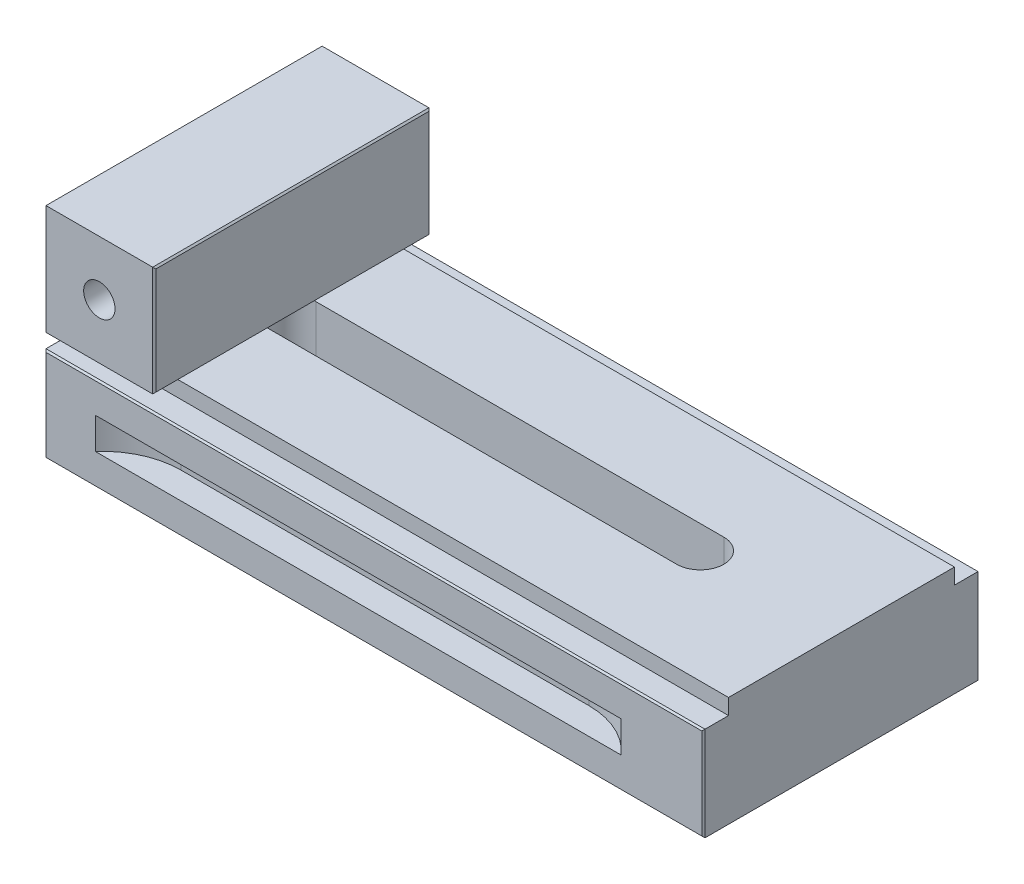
SolidWorks part; units mm, degrees
ref_plane "Face" through (0, 0, 0) normal (0, 0, 1) x (1, 0, 0)
ref_plane "Dessus" through (0, 0, 0) normal (0, 1, 0) x (1, 0, 0)
ref_plane "Droite" through (0, 0, 0) normal (1, 0, 0) x (0, 0, -1)
sketch "Esquisse1" plane through (0, 0, 0) normal (0, 0, 1) x (1, 0, 0)
  line L1 (0, 0) -> (-35, 0)
  line L2 (0, 0) -> (0, -35)
  line L3 (0, -35) -> (-35, -35)
  line L4 (-35, 0) -> (-35, -35)
  dimension "D1" = 35
  dimension "D2" = 35
extrude "Extrusion1" add sketch "Esquisse1" along normal mid plane 88
chamfer "Chanfrein1" distance 0.5 angle 45 8 edges at (-35, -17.5, 44) (0, -17.5, 44) (-35, -17.5, -44) (0, -17.5, -44) (0, -35, 0) (-35, -35, 0) (-35, 0, 0) (0, 0, 0)
sketch "Esquisse2" plane through (0, 0, 44) normal (0, 0, 1) x (1, 0, 0)
  line L0 (0, -35) -> (0, 0) construction
  line L1 (-0.5, 0) -> (-34.5, 0) construction
  circle A0 centre (-17.5, -17.5) radius 5
  dimension "D1" = 17.5
  dimension "D2" = 17.5
  dimension "D3" = 10
extrude "Enlèv. mat.-Extru.1" cut sketch "Esquisse2" against normal through all
sketch "Esquisse3" plane through (-35, 0, 0) normal (-1, 0, 0) x (0, 0, 1)
  line L0 (-36, -35) -> (36, -35)
  line L1 (44, -35) -> (-44, -35) construction
  line L2 (36, -35) -> (36, -40)
  line L3 (36, -40) -> (44, -40)
  line L4 (44, -40) -> (44, -70)
  line L5 (44, -70) -> (-44, -70)
  line L6 (-44, -70) -> (-44, -40)
  line L7 (-44, -40) -> (-36, -40)
  line L8 (-36, -40) -> (-36, -35)
  line L9 (44, 0) -> (44, -35) construction
  line L10 (-44, 0) -> (-44, -35) construction
  dimension "D1" = 8
  dimension "D2" = 5
  dimension "D3" = 35
extrude "Extrusion2" add sketch "Esquisse3" against normal blind 210
sketch "Esquisse4" plane through (0, -35, 0) normal (0, 1, 0) x (-1, 0, 0)
  line L0 (0, -7.5) -> (-130, -7.5)
  line L1 (-130, 7.5) -> (0, 7.5)
  arc A0 (-130, -7.5) -> (-130, 7.5) centre (-130, 0) cw
  arc A1 (0, -7.5) -> (0, 7.5) centre (0, 0) ccw
  dimension "D1" = 15
  dimension "D2" = 130
extrude "Enlèv. mat.-Extru.2" cut sketch "Esquisse4" against normal through all
chamfer "Chanfrein2" distance 0.5 angle 45 8 edges at (175, -55, 44) (70, -40, 44) (70, -70, 44) (175, -55, -44) (70, -70, -44) (70, -40, -44) (-35, -55, -44) (-35, -55, 44)
ref_plane "Plan1" through (0, -60, 0) normal (0, -1, 0) x (1, 0, 0)
sketch "Esquisse6" plane through (0, -60, 0) normal (0, -1, 0) x (1, 0, 0)
  line L0 (0, 35.5) -> (130, 35.5)
  line L1 (0, 85.5) -> (130, 85.5)
  line L2 (175, 43.5) -> (-35, 43.5) construction
  arc A0 (130, 35.5) -> (130, 85.5) centre (130, 60.5) ccw
  arc A1 (0, 35.5) -> (0, 85.5) centre (0, 60.5) cw
  dimension "D2" = 25
  dimension "D1" = 8
extrude "Enlèv. mat.-Extru.4" cut sketch "Esquisse6" against normal blind 10
mirror "Symétrie1" about plane through (0, 0, 0) normal (0, 0, 1) of "Enlèv. mat.-Extru.4"
